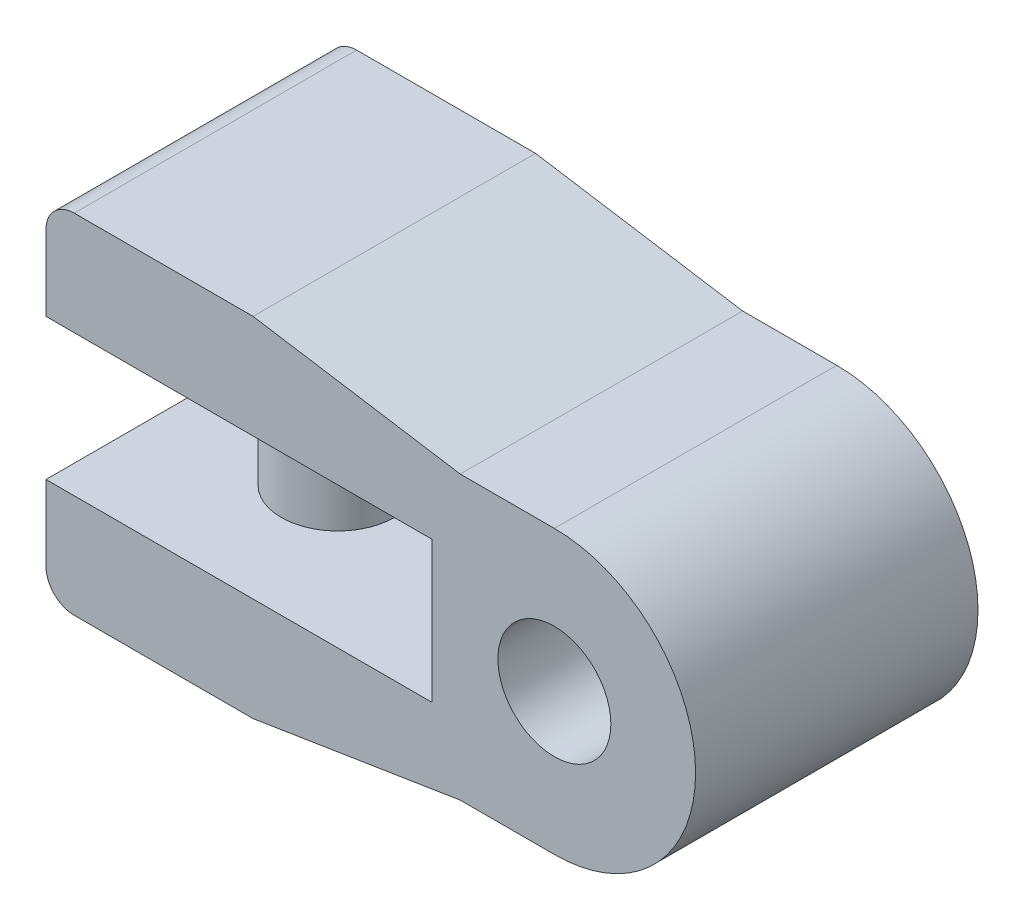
SolidWorks part; units mm, degrees
ref_plane "Plan1" through (0, 0, 0) normal (0, 0, 1) x (1, 0, 0)
ref_plane "Plan2" through (0, 0, 0) normal (0, 1, 0) x (1, 0, 0)
ref_plane "Plan3" through (0, 0, 0) normal (1, 0, 0) x (0, 0, -1)
sketch "Esquisse1" plane through (0, 0, 0) normal (0, 0, 1) x (1, 0, 0)
  line L0 (-38, 0) -> (120, 0) construction
  line L1 (41, -7.5) -> (41, 7.5)
  line L2 (41, 7.5) -> (0, 7.5)
  line L3 (0, 7.5) -> (0, 18.5)
  line L4 (0, 18.5) -> (22, 18.5)
  line L5 (22, 18.5) -> (44, 15)
  line L6 (44, 15) -> (54, 15)
  line L7 (44, -15) -> (54, -15)
  line L8 (22, -18.5) -> (44, -15)
  line L9 (0, -18.5) -> (22, -18.5)
  line L10 (0, -7.5) -> (0, -18.5)
  line L11 (41, -7.5) -> (0, -7.5)
  arc A0 (54, 15) -> (54, -15) centre (54, 0) cw
  point P16 (41, 0)
  dimension "D3" = 54
  dimension "D5" = 15
  dimension "D1" = 37
  dimension "D2" = 15
  dimension "D4" = 41
  dimension "D6" = 22
  dimension "D7" = 22
extrude "Base-Extrusion" add sketch "Esquisse1" along normal blind 30
sketch "Esquisse2" plane through (0, 0, 30) normal (0, 0, 1) x (1, 0, 0)
  circle A0 centre (54, 0) radius 6
  arc A1 (54, -15) -> (54, 15) centre (54, 0) ccw construction
  dimension "D1" = 12
extrude "Enlèv. mat.-Extru.1" cut sketch "Esquisse2" against normal through all
sketch "Esquisse3" plane through (0, 18.5, 0) normal (0, 1, 0) x (-1, 0, 0)
  line L0 (0, 15) -> (-36, 15) construction
  line L2 (0, 30) -> (0, 0) construction
  circle A0 centre (-16, 15) radius 6
  dimension "D1" = 12
fillet "Congé1" radius 3 2 edges at (0, 18.5, 15) (0, -18.5, 15)
extrude "Boss.-Extru.2" add sketch "Esquisse3" against normal through all
sketch "Esq_WRNL_Compact001" plane through (0, 0, 0) normal (0, 0, 1) x (1, 0, 0)
  line L0 (-1, -19.5) -> (-1, 19.5)
  line L1 (70, -19.5) -> (70, 19.5)
  line L2 (-1, -19.5) -> (70, -19.5)
  line L3 (-1, 19.5) -> (70, 19.5)
